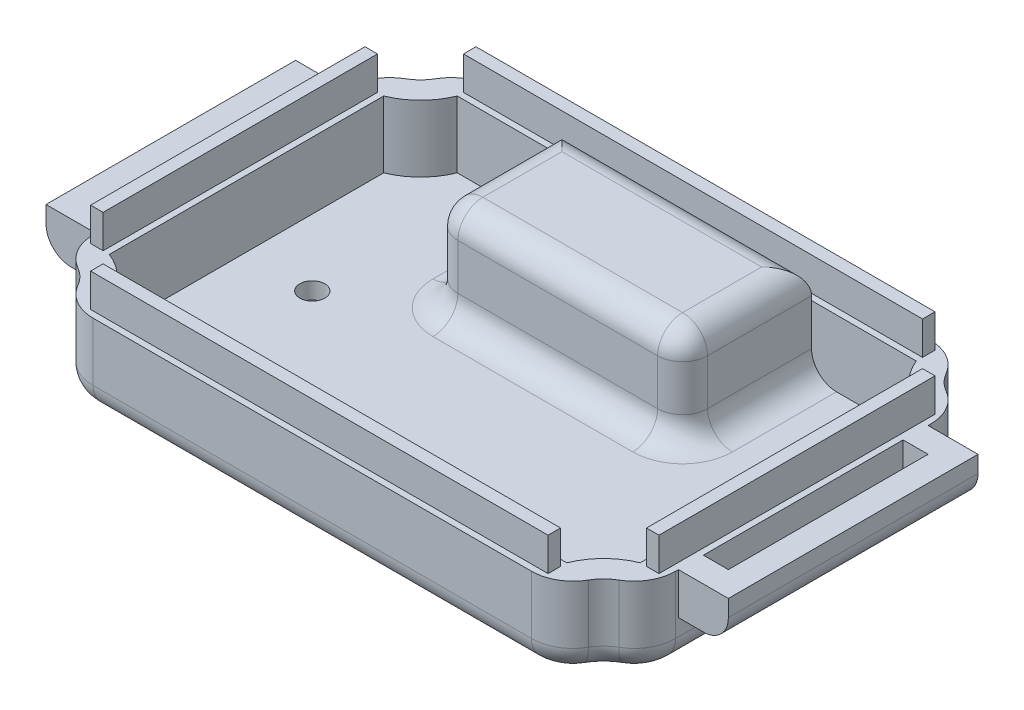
SolidWorks part; units mm, degrees
ref_plane "Front Plane" through (0, 0, 0) normal (0, 0, 1) x (1, 0, 0)
ref_plane "Top Plane" through (0, 0, 0) normal (0, 1, 0) x (1, 0, 0)
ref_plane "Right Plane" through (0, 0, 0) normal (1, 0, 0) x (0, 0, -1)
sketch "Sketch1" plane through (0, 0, 0) normal (0, 1, 0) x (1, 0, 0)
  line L1 (30, 24) -> (-30, 24)
  line L2 (35, 19) -> (35, -19)
  line L3 (30, -24) -> (-30, -24)
  line L4 (-35, 19) -> (-35, -19)
  line L5 (35, 24) -> (-35, -24) construction
  line L6 (35, -24) -> (-35, 24) construction
  arc A0 (-35, 19) -> (-30, 24) centre (-35, 24) ccw
  arc A1 (30, 24) -> (35, 19) centre (35, 24) ccw
  arc A2 (-30, -24) -> (-35, -19) centre (-35, -24) ccw
  arc A3 (35, -19) -> (30, -24) centre (35, -24) ccw
  point P0 (0, 0)
  dimension "D1" = 70
  dimension "D2" = 48
extrude "Boss-Extrude1" add sketch "Sketch1" along normal blind 10
sketch "Sketch2" plane through (0, 10, 0) normal (0, 1, 0) x (1, 0, 0)
  line L0 (-27.5838, 21) -> (27.5838, 21)
  line L1 (32, 16.5838) -> (32, -16.5838)
  line L2 (-27.3874, -21) -> (27.5838, -21)
  line L3 (-32, 16.5838) -> (-32, -16.3874)
  line L4 (30, 24) -> (-30, 24) construction
  line L5 (-35, 19) -> (-35, -19) construction
  line L6 (35, -19) -> (35, 19) construction
  line L7 (-30, -24) -> (30, -24) construction
  arc A0 (-32, 16.5838) -> (-27.5838, 21) centre (-35, 24) ccw
  arc A1 (-27.3874, -21) -> (-32, -16.3874) centre (-35, -24) ccw
  arc A2 (27.5838, 21) -> (32, 16.5838) centre (35, 24) ccw
  arc A3 (32, -16.5838) -> (27.5838, -21) centre (35, -24) ccw
  arc A4 (-30, -24) -> (-35, -19) centre (-35, -24) ccw construction
  arc A5 (-35, 19) -> (-30, 24) centre (-35, 24) ccw construction
  arc A6 (30, 24) -> (35, 19) centre (35, 24) ccw construction
  arc A7 (35, -19) -> (30, -24) centre (35, -24) ccw construction
  dimension "D1" = 3
  dimension "D2" = 3
  dimension "D3" = 3
  dimension "D4" = 3
extrude "Cut-Extrude1" cut sketch "Sketch2" against normal blind 8
sketch "Sketch4" plane through (0, 10, 0) normal (0, 1, 0) x (1, 0, 0)
  line L0 (35, -19) -> (35, 19) construction
  line L4 (35, 15) -> (35, 12)
  line L5 (35, 12) -> (35, 0)
  line L7 (-35, 19) -> (-35, -19) construction
  line L8 (-35, 15) -> (-41, 15)
  line L9 (-35, 15) -> (-35, -15)
  line L10 (-35, -15) -> (-41, -15)
  line L11 (-41, 15) -> (-41, -15)
  line L12 (-35, 15) -> (-41, -15) construction
  line L13 (-35, -15) -> (-41, 15) construction
  line L14 (0, 0) -> (-43.9534, 0) construction
  line L15 (0, 0) -> (53.124, 0) construction
  line L20 (35, 0) -> (35, -15)
  line L21 (41, 15) -> (35, 15)
  line L23 (-35, 12) -> (-38, 12)
  line L24 (-35, 12) -> (-35, -12)
  line L25 (-35, -12) -> (-38, -12)
  line L26 (-38, 12) -> (-38, -12)
  line L27 (-35, 12) -> (-38, -12) construction
  line L28 (-35, -12) -> (-38, 12) construction
  line L29 (41, 15) -> (41, -15)
  line L30 (41, -15) -> (35, -15)
  line L31 (35, 15) -> (35, -15)
  line L32 (41, 15) -> (35, -15) construction
  line L33 (41, -15) -> (35, 15) construction
  line L34 (35, 12) -> (38, 12)
  line L35 (35, 12) -> (35, -12)
  line L36 (35, -12) -> (38, -12)
  line L37 (38, 12) -> (38, -12)
  point P0 (38, 0)
  point P2 (38, 0)
  point P7 (-38, 0)
  point P14 (-38, 15)
  point P19 (38, 0)
  point P24 (-36.5, 0)
  point P29 (36.6175, 0)
  point P35 (38, 15)
  dimension "D1" = 6
  dimension "D2" = 30
  dimension "D3" = 3
  dimension "D4" = 3
  dimension "D5" = 15
  dimension "D6" = 15
  dimension "D7" = 3
  dimension "D8" = 6
  dimension "D9" = 3
  dimension "D10" = 0
  dimension "D11" = 3
extrude "Boss-Extrude2" add sketch "Sketch4" against normal blind 5 contours L26 L23 L9 L8 L11 L10 L25 | L34 L37 L36 L20 L30 L29 L21 L4 M30
fillet "Fillet3" radius 3 1 edges at (-41, 5, 0)
fillet "Fillet4" radius 3 1 edges at (41, 5, 0)
fillet "Fillet5" radius 5 8 edges at (-35, 5, -19) (-30, 5, -24) (30, 5, -24) (35, 5, -19) (30, 5, 24) (35, 5, 19) (-30, 5, 24) (-35, 5, 19)
sketch "Sketch11" plane through (0, 0, 0) normal (0, -1, 0) x (-1, 0, 0)
  line L0 (0, 29.7374) -> (0, -7.7597) construction
  line L2 (-15, 5.5) -> (15, 5.5)
  line L3 (-15, 5.5) -> (-15, 21)
  line L4 (-15, 21) -> (15, 21)
  line L5 (15, 5.5) -> (15, 21)
  line L6 (-15, 5.5) -> (15, 21) construction
  line L7 (-15, 21) -> (15, 5.5) construction
  point P3 (0, 13.25)
  dimension "D1" = 15.5
  dimension "D2" = 30
fillet "Fillet8" radius 3 16 edges at (-34.3301, 0, 17.8397) (-31.4645, 0, 20.4645) (-28.8397, 0, 23.3301) (0, 0, 24) (28.8397, 0, 23.3301) (31.4645, 0, 20.4645) (34.3301, 0, 17.8397) (35, 0, 0) (34.3301, 0, -17.8397) (31.4645, 0, -20.4645) (28.8397, 0, -23.3301) (0, 0, -24) (-28.8397, 0, -23.3301) (-31.4645, 0, -20.4645) (-34.3301, 0, -17.8397) (-35, 0, 0)
extrude "Cut-Extrude7" cut sketch "Sketch11" against normal blind 1 contours L3 L2 L5 L4
sketch "Sketch12" plane through (0, 1, 0) normal (0, -1, 0) x (1, 0, 0)
  line L0 (-15, -5.5) -> (-15, -21) construction
  line L1 (15, -5.5) -> (-15, -5.5)
  line L2 (15, -5.5) -> (15, -21)
  line L3 (15, -21) -> (-15, -21)
  line L4 (-15, -5.5) -> (-15, -21)
  line L5 (15, -5.5) -> (-15, -21) construction
  line L6 (15, -21) -> (-15, -5.5) construction
  line L7 (15, -5.5) -> (-15, -5.5) construction
  line L8 (15, -5.5) -> (15, -21) construction
  point P0 (0, -13.25)
  dimension "D1" = 0
  dimension "D2" = 0
sketch "Sketch16" plane through (0, 1, 0) normal (0, -1, 0) x (1, 0, 0)
  line L0 (-15, -5.5) -> (-15, -21) construction
  line L1 (14, -6.5) -> (-14, -6.5)
  line L2 (14, -6.5) -> (14, -20)
  line L3 (14, -20) -> (-14, -20)
  line L4 (-14, -6.5) -> (-14, -20)
  line L5 (14, -6.5) -> (-14, -20) construction
  line L6 (14, -20) -> (-14, -6.5) construction
  line L7 (15, -5.5) -> (-15, -5.5) construction
  point P0 (0, -13.25)
  dimension "D1" = 1
  dimension "D2" = 1
extrude "Boss-Extrude12" add sketch "Sketch16" against normal blind 12.5
sketch "Sketch17" plane through (0, 1, 0) normal (0, -1, 0) x (1, 0, 0)
  line L0 (15, -5.5) -> (-15, -21) construction
  line L1 (15, -5.5) -> (-15, -5.5)
  line L2 (15, -5.5) -> (15, -21)
  line L3 (15, -21) -> (-15, -21)
  line L4 (-15, -5.5) -> (-15, -21)
  line L5 (15, -5.5) -> (-15, -21) construction
  line L6 (15, -21) -> (-15, -5.5) construction
  line L7 (15, -5.5) -> (-15, -5.5) construction
  point P0 (0, -13.25)
  dimension "D1" = 0
extrude "Boss-Extrude13" add sketch "Sketch17" against normal blind 12.5 contours L2 L1 L4 L3
sketch "Sketch18" plane through (0, 1, 0) normal (0, -1, 0) x (1, 0, 0)
  line L0 (15, -5.5) -> (-15, -5.5) construction
  line L1 (14, -6.5) -> (-14, -6.5)
  line L2 (14, -6.5) -> (14, -20)
  line L3 (14, -20) -> (-14, -20)
  line L4 (-14, -6.5) -> (-14, -20)
  line L5 (14, -6.5) -> (-14, -20) construction
  line L6 (14, -20) -> (-14, -6.5) construction
  line L7 (15, -5.5) -> (15, -21) construction
  point P0 (0, -13.25)
  dimension "D1" = 1
  dimension "D2" = 1
sketch "Sketch20" plane through (0, 1, 0) normal (0, -1, 0) x (1, 0, 0)
  line L1 (14, -6.5) -> (-14, -6.5)
  line L2 (14, -6.5) -> (14, -20)
  line L3 (14, -20) -> (-14, -20)
  line L4 (-14, -6.5) -> (-14, -20)
  line L5 (14, -6.5) -> (-14, -20) construction
  line L6 (14, -20) -> (-14, -6.5) construction
  point P0 (0, -13.25)
extrude "Cut-Extrude10" cut sketch "Sketch20" against normal blind 5.65
sketch "Sketch21" plane through (0, 6.65, 0) normal (0, -1, 0) x (1, 0, 0)
  line L0 (-25.6466, -13.25) -> (64.1547, -13.25) construction
  line L1 (-12, -13.25) -> (12, -13.25)
  line L4 (12, -7.5) -> (-12, -7.5)
  line L5 (12, -7.5) -> (12, -13.25)
  line L7 (-12, -7.5) -> (-12, -13.25)
  line L8 (12, -7.5) -> (-12, -19) construction
  line L9 (12, -19) -> (-12, -7.5) construction
  dimension "D1" = 11.5
  dimension "D2" = 24
revolve "Cut-Revolve5" cut sketch "Sketch21" angle 180 about L0
sketch "Sketch22" plane through (0, 6.65, 0) normal (0, -1, 0) x (1, 0, 0)
  line L1 (14, -6.5) -> (-14, -6.5)
  line L2 (14, -6.5) -> (14, -20)
  line L3 (14, -20) -> (-14, -20)
  line L4 (-14, -6.5) -> (-14, -20)
  line L5 (14, -6.5) -> (-14, -20) construction
  line L6 (14, -20) -> (-14, -6.5) construction
  point P0 (0, -13.25)
  point P5 (-14, -6.5)
extrude "Cut-Extrude11" cut sketch "Sketch22" against normal blind 0.75
fillet "Fillet7" radius 3 9 edges at (15, 2, -13.25) (-15, 2, -13.25) (0, 2, -5.5) (0, 13.5, -5.5) (15, 7.75, -5.5) (-15, 7.75, -5.5) (0, 13.5, -21) (15, 13.5, -13.25) (-15, 13.5, -13.25)
ref_plane "Plane2" through (0, 0, -21) normal (0, 0, 1) x (1, 0, 0)
sketch "Sketch24" plane through (0, 0, -21) normal (0, 0, 1) x (1, 0, 0)
  line L0 (0, -9.8405) -> (0, 11.4287) construction
  line L1 (15, 1) -> (15, 0) construction
  line L2 (-15, 1) -> (-15, 0) construction
  line L4 (2.75, 0.4) -> (-2.75, 0.4)
  line L5 (2.75, 0.4) -> (2.75, 1)
  line L6 (2.75, 1) -> (-2.75, 1)
  line L7 (-2.75, 0.4) -> (-2.75, 1)
  line L8 (15, 1) -> (-15, 1) construction
  dimension "D1" = 5.5
  dimension "D2" = 0.6
extrude "Cut-Extrude12" cut sketch "Sketch24" against normal blind 1
ref_plane "Plane3" through (0, 1, 0) normal (0, -1, 0) x (-1, 0, 0)
sketch "Sketch25" plane through (0, 1, 0) normal (0, -1, 0) x (-1, 0, 0)
  line L0 (-14, 6.5) -> (14, 6.5) construction
  line L1 (-2.5, 6.5) -> (2.5, 6.5)
  line L2 (-2.5, 6.5) -> (-2.5, 5.5)
  line L3 (-2.5, 5.5) -> (2.5, 5.5)
  line L4 (2.5, 6.5) -> (2.5, 5.5)
  line L5 (-15, 5.5) -> (15, 5.5) construction
  line L8 (0, -6.2363) -> (0, 17.6776) construction
  line L9 (-15, 5.5) -> (-15, 21) construction
  line L10 (15, 5.5) -> (15, 21) construction
  dimension "D1" = 5
extrude "Cut-Extrude13" cut sketch "Sketch25" against normal blind 3 contours L2 L1 L4 L3
ref_plane "Plane4" through (0, 0, -5.5) normal (0, 0, -1) x (-1, 0, 0)
sketch "Sketch26" plane through (0, 0, -5.5) normal (0, 0, -1) x (-1, 0, 0)
  line L1 (-2.5, 4) -> (2.5, 4)
  line L2 (-2.5, 4) -> (-2.5, -0.8523)
  line L3 (-2.5, -0.8523) -> (2.5, -0.8523)
  line L4 (2.5, 4) -> (2.5, -0.8523)
  line L5 (2.5, 4) -> (2.5, 1) construction
  line L6 (-3.0484, 4) -> (3.2188, 4) construction
revolve "Cut-Revolve6" cut sketch "Sketch26" angle 5 about L6
sketch "Sketch27" plane through (0, 0, -5.5) normal (0, 0, -1) x (-1, 0, 0)
  line L1 (-2.5, 1) -> (2.5, 1)
  line L2 (-2.5, 1) -> (-2.5, 0)
  line L3 (-2.5, 0) -> (2.5, 0)
  line L4 (2.5, 1) -> (2.5, 0)
extrude "Cut-Extrude14" cut sketch "Sketch27" against normal blind 2
sketch "Sketch29" plane through (0, 2, 0) normal (0, 1, 0) x (1, 0, 0)
  circle A1 centre (0, -15.3063) radius 1.5
  dimension "D1" = 3
extrude "Cut-Extrude15" cut sketch "Sketch29" against normal blind 10
sketch "Sketch30" plane through (0, 0, 0) normal (0, -1, 0) x (1, 0, 0)
  line L0 (-32, 0) -> (32, 0) construction
  circle A1 centre (-24, 0) radius 1.5
  circle A2 centre (24, 0.3135) radius 1.5
  dimension "D3" = 3
  dimension "D4" = 3
extrude "Cut-Extrude16" cut sketch "Sketch30" against normal blind 10
sketch "Sketch31" plane through (0, 10, 0) normal (0, 1, 0) x (1, 0, 0)
  line L0 (-27.3874, -21) -> (27.5838, -21) construction
  line L1 (-27.5838, 21.75) -> (27.5838, 21.75)
  line L2 (-27.5838, 21.75) -> (-27.5838, 23.25)
  line L3 (-27.5838, 23.25) -> (27.5838, 23.25)
  line L4 (27.5838, 21.75) -> (27.5838, 23.25)
  line L5 (-32, 16.5838) -> (-32, -16.3874) construction
  line L6 (-27.3874, -21.75) -> (27.5838, -21.75)
  line L7 (-27.3874, -21.75) -> (-27.3874, -23.25)
  line L8 (-27.3874, -23.25) -> (27.5838, -23.25)
  line L9 (27.5838, -21.75) -> (27.5838, -23.25)
  line L10 (-32.75, -16.3874) -> (-34.25, -16.3874)
  line L11 (-32.75, -16.3874) -> (-32.75, 16.5838)
  line L12 (-32.75, 16.5838) -> (-34.25, 16.5838)
  line L13 (-34.25, -16.3874) -> (-34.25, 16.5838)
  line L14 (32.75, -16.5838) -> (34.25, -16.5838)
  line L15 (32.75, -16.5838) -> (32.75, 16.5838)
  line L16 (32.75, 16.5838) -> (34.25, 16.5838)
  line L17 (34.25, -16.5838) -> (34.25, 16.5838)
  line L19 (-18, 21) -> (-27.5838, 21) construction
  line L21 (32, -16.5838) -> (32, 16.5838) construction
  dimension "D1" = 1.5
  dimension "D2" = 1.5
  dimension "D3" = 1.5
  dimension "D4" = 1.5
  dimension "D5" = 0.75
  dimension "D6" = 0.75
  dimension "D7" = 0.75
  dimension "D8" = 0.75
extrude "Boss-Extrude15" add sketch "Sketch31" along normal blind 4
